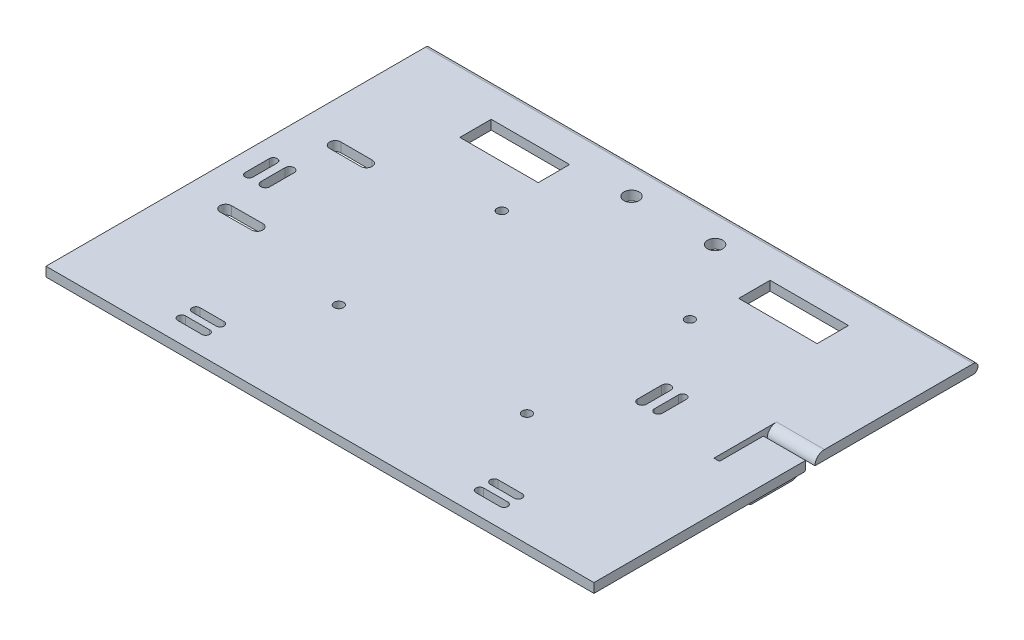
SolidWorks part; units mm, degrees
ref_plane "Front Plane" through (0, 0, 0) normal (0, 0, 1) x (1, 0, 0)
ref_plane "Top Plane" through (0, 0, 0) normal (0, 1, 0) x (1, 0, 0)
ref_plane "Right Plane" through (0, 0, 0) normal (1, 0, 0) x (0, 0, -1)
sketch "Sketch1" plane through (0, 0, 0) normal (0, 1, 0) x (1, 0, 0)
  line L1 (-87.4, 62) -> (87.4, 62)
  line L2 (-87.4, 62) -> (-87.4, -62)
  line L3 (-87.4, -62) -> (87.4, -62)
  line L4 (87.4, 62) -> (87.4, -62)
  line L5 (-87.4, 62) -> (87.4, -62) construction
  line L6 (-87.4, -62) -> (87.4, 62) construction
  point P0 (0, 0)
  dimension "D1" = 124
  dimension "D2" = 174.8
extrude "Boss-Extrude1" add sketch "Sketch1" along normal blind 3
sketch "Sketch2" plane through (0, 3, 0) normal (0, 1, 0) x (1, 0, 0)
  line L0 (0, -62) -> (0, 62) construction
  line L1 (-87.4, -62) -> (87.4, -62) construction
  line L2 (87.4, 62) -> (-87.4, 62) construction
  circle A0 centre (-13.335, 50.709) radius 2.413
  circle A1 centre (13.335, 50.709) radius 2.413
  dimension "D5" = 4.826
extrude "Cut-Extrude1" cut sketch "Sketch2" against normal up to surface (3 mm away)
sketch "Sketch3" plane through (0, 3, 0) normal (0, 1, 0) x (1, 0, 0)
  line L0 (87.4, 0) -> (-87.4, 0) construction
  line L1 (87.4, -62) -> (87.4, 62) construction
  line L2 (-87.4, 62) -> (-87.4, -62) construction
  line L3 (73.938, 5.5) -> (87.4, 5.5)
  line L20 (87.4, 8.5) -> (87.4, 5.5)
  line L24 (73.938, -8.5) -> (72.16, -8.5)
  line L27 (87.4, 8.5) -> (72.16, 8.5)
  line L29 (72.16, -8.5) -> (72.16, 8.5)
  line L30 (73.938, 5.5) -> (73.938, -8.5)
  point P6 (72.16, 0)
  dimension "D1" = 17
  dimension "D2" = 3
  dimension "D3" = 15.24
extrude "Cut-Extrude2" cut sketch "Sketch3" against normal up to surface (3 mm away)
sketch "Sketch9" plane through (0, 0, 0) normal (0, -1, 0) x (1, 0, 0)
  line L1 (73.938, -5.5) -> (85.9, -5.5)
  line L2 (73.938, -5.5) -> (73.938, 8.5)
  line L3 (73.938, 11.5) -> (85.9, 11.5)
  line L5 (72.16, 8.5) -> (72.16, -8.5) construction
  line L6 (73.938, 8.5) -> (72.16, 8.5)
  line L8 (73.938, 11.5) -> (69.938, 11.5)
  line L9 (69.938, 8.5) -> (69.938, 11.5)
  line L11 (69.938, 8.5) -> (69.938, 7.5)
  line L12 (69.938, 7.5) -> (72.16, 7.5)
  line L13 (72.16, 8.5) -> (72.16, 7.5)
  line L18 (85.9, 11.5) -> (85.9, -5.5)
  dimension "D2" = 4
  dimension "D3" = 1
extrude "Boss-Extrude6" add sketch "Sketch9" along normal blind 2
fillet "Fillet7" radius 1.5 3 edges at (71.049, -2, 7.5) (69.938, -2, 9.5) (77.919, -2, 11.5)
fillet "Fillet8" radius 3 2 edges at (73.938, -2, 1.75) (79.919, -2, -5.5)
fillet "Fillet10" radius 3 1 edges at (79.78, 3, -8.5)
sketch "Sketch10" plane through (0, 0, 0) normal (0, -1, 0) x (1, 0, 0)
  line L0 (-13.335, -50.709) -> (13.335, -50.709) construction
  line L1 (-87.4, 0) -> (72.16, -0.5) construction
  line L2 (-87.4, -62) -> (-87.4, 62) construction
  line L3 (-56.9778, -49.5977) -> (-31.9778, -49.5977)
  line L4 (-56.9778, -49.5977) -> (-56.9778, -39.5977)
  line L5 (-56.9778, -39.5977) -> (-31.9778, -39.5977)
  line L6 (-31.9778, -49.5977) -> (-31.9778, -39.5977)
  line L7 (72.16, 7.5) -> (72.16, -8.5) construction
  line L8 (0, 0) -> (0, -62) construction
  line L10 (87.4, -62) -> (-87.4, -62) construction
  line L11 (56.9778, -39.5977) -> (31.9778, -39.5977)
  line L12 (31.9778, -49.5977) -> (31.9778, -39.5977)
  line L13 (56.9778, -49.5977) -> (31.9778, -49.5977)
  line L14 (56.9778, -49.5977) -> (56.9778, -39.5977)
  line L15 (-74.7161, -17.5592) -> (-64.7161, -17.5592) construction
  line L18 (-74.7161, -15.7674) -> (-64.7161, -15.7674)
  line L19 (-74.7161, -19.3509) -> (-64.7161, -19.3509)
  line L20 (-74.6063, 17.4793) -> (-64.6065, 17.4167) construction
  line L21 (-74.6175, 15.6876) -> (-64.6177, 15.625)
  line L22 (-74.5951, 19.2711) -> (-64.5953, 19.2084)
  arc A8 (-74.7161, -15.7674) -> (-74.7161, -19.3509) centre (-74.7161, -17.5592) ccw
  arc A9 (-64.7161, -19.3509) -> (-64.7161, -15.7674) centre (-64.7161, -17.5592) ccw
  arc A10 (-74.6175, 15.6876) -> (-74.5951, 19.2711) centre (-74.6063, 17.4793) cw
  arc A11 (-64.5953, 19.2084) -> (-64.6177, 15.625) centre (-64.6065, 17.4167) cw
  point P16 (-69.7161, -17.5592)
  point P20 (0, 0)
  point P38 (-69.6064, 17.448)
  dimension "D3" = 10
  dimension "D1" = 25
  dimension "D2" = 10
extrude "Cut-Extrude5" cut sketch "Sketch10" against normal up to surface (3 mm away)
sketch "Sketch11" plane through (0, 0, 0) normal (0, -1, 0) x (1, 0, 0)
  line L0 (87.4, -8.5) -> (87.4, -62) construction
  line L1 (-87.4, -62) -> (87.4, -62)
  line L2 (-87.4, -62) -> (-87.4, -60.5)
  line L3 (-87.4, -60.5) -> (87.4, -60.5)
  line L4 (87.4, -62) -> (87.4, -60.5)
  dimension "D1" = 1.5
extrude "Cut-Extrude6" cut sketch "Sketch11" against normal up to surface (3 mm away)
fillet "Fillet11" radius 1.5 2 edges at (0, 3, -60.5) (0, 0, -60.5)
sketch "Sketch12" plane through (0, 0, 0) normal (0, -1, 0) x (1, 0, 0)
  circle A0 centre (30, 26) radius 1.5
  circle A1 centre (-30, 26) radius 1.5
  circle A2 centre (-30, -26) radius 1.5
  circle A3 centre (30, -26) radius 1.5
  point P0 (0, 0)
  dimension "D5" = 3
extrude "Cut-Extrude7" cut sketch "Sketch12" against normal up to surface (3 mm away)
sketch "Sketch13" plane through (0, 0, 0) normal (0, -1, 0) x (1, 0, 0)
  line L0 (-80.2706, 4.3335) -> (-80.2706, -3.371) construction
  line L1 (-79.0163, 4.3335) -> (-79.0163, -3.371)
  line L2 (-81.5248, 4.3335) -> (-81.5248, -3.371)
  line L3 (-75.0745, 4.3335) -> (-75.0745, -3.371) construction
  line L4 (-73.6411, 4.3335) -> (-73.6411, -3.371)
  line L5 (-76.5079, 4.3335) -> (-76.5079, -3.371)
  line L6 (-51.4042, 54.7246) -> (-43.6996, 54.7246) construction
  line L8 (-51.4042, 55.9788) -> (-43.6996, 55.9788)
  line L9 (-51.4042, 53.4703) -> (-43.6996, 53.4703)
  line L10 (45.0745, 4.3335) -> (45.0745, -3.371) construction
  line L11 (43.6411, 4.3335) -> (43.6411, -3.371)
  line L12 (46.5079, 4.3335) -> (46.5079, -3.371)
  line L13 (50.2706, 4.3335) -> (50.2706, -3.371) construction
  line L14 (49.0163, 4.3335) -> (49.0163, -3.371)
  line L15 (51.5248, 4.3335) -> (51.5248, -3.371)
  line L16 (-51.4042, 50.1401) -> (-43.6996, 50.1401) construction
  line L17 (-51.4042, 51.3943) -> (-43.6996, 51.3943)
  line L18 (-51.4042, 48.8859) -> (-43.6996, 48.8859)
  line L19 (0, 0) -> (0, 62) construction
  line L20 (-87.4, 62) -> (87.4, 62) construction
  line L21 (51.4042, 50.1401) -> (43.6996, 50.1401) construction
  line L22 (51.4042, 51.3943) -> (43.6996, 51.3943)
  line L23 (51.4042, 48.8859) -> (43.6996, 48.8859)
  line L24 (51.4042, 54.7246) -> (43.6996, 54.7246) construction
  line L25 (51.4042, 55.9788) -> (43.6996, 55.9788)
  line L26 (51.4042, 53.4703) -> (43.6996, 53.4703)
  arc A0 (-79.0163, 4.3335) -> (-81.5248, 4.3335) centre (-80.2706, 4.3335) ccw
  arc A1 (-81.5248, -3.371) -> (-79.0163, -3.371) centre (-80.2706, -3.371) ccw
  arc A2 (-73.6411, 4.3335) -> (-76.5079, 4.3335) centre (-75.0745, 4.3335) ccw
  arc A3 (-76.5079, -3.371) -> (-73.6411, -3.371) centre (-75.0745, -3.371) ccw
  arc A4 (43.6411, 4.3335) -> (46.5079, 4.3335) centre (45.0745, 4.3335) cw
  arc A5 (46.5079, -3.371) -> (43.6411, -3.371) centre (45.0745, -3.371) cw
  arc A6 (49.0163, 4.3335) -> (51.5248, 4.3335) centre (50.2706, 4.3335) cw
  arc A7 (51.5248, -3.371) -> (49.0163, -3.371) centre (50.2706, -3.371) cw
  arc A8 (-51.4042, 55.9788) -> (-51.4042, 53.4703) centre (-51.4042, 54.7246) ccw
  arc A9 (-43.6996, 53.4703) -> (-43.6996, 55.9788) centre (-43.6996, 54.7246) ccw
  arc A10 (-51.4042, 51.3943) -> (-51.4042, 48.8859) centre (-51.4042, 50.1401) ccw
  arc A11 (-43.6996, 48.8859) -> (-43.6996, 51.3943) centre (-43.6996, 50.1401) ccw
  arc A12 (51.4042, 51.3943) -> (51.4042, 48.8859) centre (51.4042, 50.1401) cw
  arc A13 (43.6996, 48.8859) -> (43.6996, 51.3943) centre (43.6996, 50.1401) cw
  arc A14 (51.4042, 55.9788) -> (51.4042, 53.4703) centre (51.4042, 54.7246) cw
  arc A15 (43.6996, 53.4703) -> (43.6996, 55.9788) centre (43.6996, 54.7246) cw
  point P2 (-80.2706, 0.4812)
  point P7 (-75.0745, 0.4812)
  point P16 (-47.5519, 54.7246)
  point P26 (45.0745, 0.4812)
  point P33 (50.2706, 0.4812)
  point P38 (-47.5519, 50.1401)
  point P51 (47.5519, 50.1401)
  point P58 (47.5519, 54.7246)
extrude "Cut-Extrude9" cut sketch "Sketch13" against normal up to surface (3 mm away)
